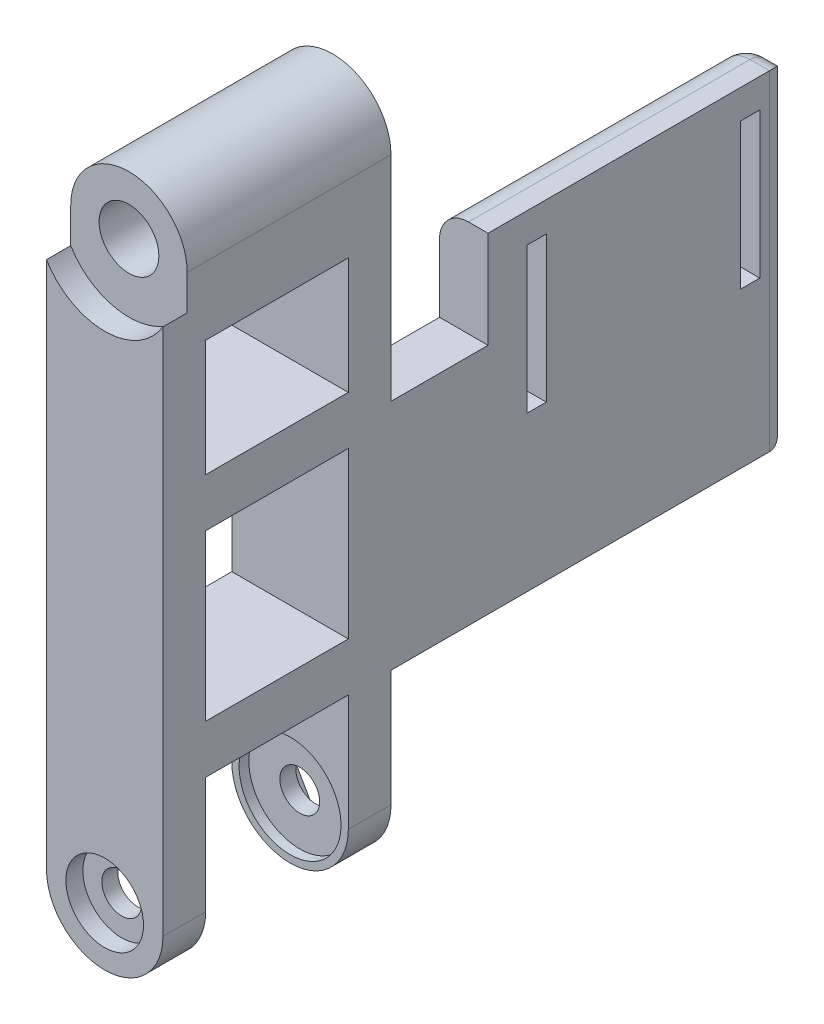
SolidWorks part; units mm, degrees
ref_plane "前视基准面" through (0, 0, 0) normal (0, 0, 1) x (1, 0, 0)
ref_plane "上视基准面" through (0, 0, 0) normal (0, 1, 0) x (1, 0, 0)
ref_plane "右视基准面" through (0, 0, 0) normal (1, 0, 0) x (0, 0, -1)
other "Configuration Table"
sketch "草图1" plane through (0, 0, 0) normal (0, 0, 1) x (1, 0, 0)
  line L2 (0, 0) -> (0, 58)
  line L4 (12, 0) -> (12, 58)
  arc A0 (0, 58) -> (12, 58) centre (6, 58) cw
  arc A1 (12, 0) -> (0, 0) centre (6, 0) cw
  circle A2 centre (6, 58) radius 3.08
  circle A3 centre (6, 0) radius 2.05
  dimension "D1" = 12
  dimension "D2" = 58
extrude "凸台-拉伸7" add sketch "草图1" against normal blind 25.5
sketch "草图6" plane through (12, 0, 0) normal (1, 0, 0) x (0, 0, -1)
  line L1 (5.4, -6) -> (20.1, -6)
  line L2 (5.4, -6) -> (5.4, 12)
  line L3 (5.4, 12) -> (20.1, 12)
  line L4 (20.1, -6) -> (20.1, 12)
  line L5 (0, 0) -> (0, -6) construction
  line L7 (5.4, 17) -> (20.1, 17)
  line L8 (5.4, 17) -> (5.4, 34)
  line L9 (5.4, 34) -> (20.1, 34)
  line L10 (20.1, 17) -> (20.1, 34)
  line L15 (5.4, 39) -> (20.1, 39)
  line L24 (5.4, 39) -> (5.4, 51)
  line L25 (5.4, 51) -> (20.1, 51)
  line L26 (20.1, 39) -> (20.1, 51)
  dimension "D6" = 12
  dimension "D1" = 14.7
  dimension "D2" = 5.4
  dimension "D3" = 5
  dimension "D4" = 5
  dimension "D5" = 17
extrude "切除-拉伸1" cut sketch "草图6" against normal blind 20
sketch "草图7" plane through (0, 0, 0) normal (0, 0, 1) x (1, 0, 0)
  circle A0 centre (6, 0) radius 3.15
extrude "切除-拉伸2" cut sketch "草图7" against normal blind 2.75
sketch "草图8" plane through (0, 0, -25.5) normal (0, 0, -1) x (-1, 0, 0)
  line L1 (-2.6514, 0) -> (-4.3257, 2.9)
  line L2 (-4.3257, 2.9) -> (-7.6743, 2.9)
  line L3 (-7.6743, 2.9) -> (-9.3486, 0)
  line L4 (-9.3486, 0) -> (-7.6743, -2.9)
  line L5 (-7.6743, -2.9) -> (-4.3257, -2.9)
  line L6 (-4.3257, -2.9) -> (-2.6514, 0)
  circle A0 centre (-6, 0) radius 2.9 construction
extrude "切除-拉伸3" cut sketch "草图8" against normal blind 2.75
sketch "草图9" plane through (0, 0, -25.5) normal (0, 0, -1) x (-1, 0, 0)
  line L5 (-12, 12) -> (-7, 12)
  line L6 (-12, 0) -> (-12, 58) construction
  line L7 (-12, 36) -> (-7, 36)
  line L8 (-12, 36) -> (-12, 12)
  line L10 (-7, 36) -> (-7, 12)
  circle A0 centre (-6, 0) radius 2.05 construction
  dimension "D1" = 12
  dimension "D2" = 24
  dimension "D3" = 5
extrude "凸台-拉伸8" add sketch "草图9" along normal blind 40
sketch "草图11" plane through (0, 0, 0) normal (0, 0, 1) x (1, 0, 0)
  circle A0 centre (6, 58) radius 7
extrude "切除-拉伸5" cut sketch "草图11" against normal blind 3.5
sketch "草图12" plane through (0, 0, -25.5) normal (0, 0, -1) x (-1, 0, 0)
  circle A0 centre (-6, 58) radius 7
extrude "切除-拉伸6" cut sketch "草图12" against normal blind 1
sketch "草图13" plane through (0, 0, 0) normal (0, 0, 1) x (1, 0, 0)
  line L0 (0, 0) -> (0, 54.3944)
  line L1 (12, 54.3944) -> (12, 0)
  arc A0 (0, 54.3944) -> (12, 54.3944) centre (6, 58) ccw
  arc A1 (0, 0) -> (12, 0) centre (6, 0) ccw
extrude "切除-拉伸7" cut sketch "草图13" against normal blind 1
sketch "草图14" plane through (0, 0, -25.5) normal (0, 0, -1) x (-1, 0, 0)
  line L0 (-12, 54.3944) -> (-12, 36)
  line L1 (-12, 36) -> (-7, 36)
  line L2 (-7, 36) -> (-7, 12)
  line L3 (-7, 12) -> (-12, 12)
  line L4 (-12, 12) -> (-12, 0)
  line L5 (0, 54.3944) -> (0, 0)
  arc A0 (-12, 54.3944) -> (0, 54.3944) centre (-6, 58) ccw
  arc A1 (-12, 0) -> (0, 0) centre (-6, 0) ccw
extrude "切除-拉伸8" cut sketch "草图14" against normal blind 1
sketch "草图15" plane through (0, 0, -5.4) normal (0, 0, -1) x (-1, 0, 0)
  circle A0 centre (-6, 0) radius 5.25
extrude "切除-拉伸9" cut sketch "草图15" against normal blind 1
sketch "草图16" plane through (0, 0, -20.1) normal (0, 0, 1) x (1, 0, 0)
  circle A0 centre (6, 0) radius 5.25
extrude "切除-拉伸10" cut sketch "草图16" against normal blind 1
fillet "圆角1" radius 3 1 edges at (7, 12, -45)
sketch "草图17" plane through (0, 36, 0) normal (0, 1, 0) x (1, 0, 0)
  line L0 (12, 65.5) -> (12, 24.5) construction
  line L1 (7, 65.5) -> (12, 65.5)
  line L2 (7, 65.5) -> (7, 34.5)
  line L3 (7, 34.5) -> (12, 34.5)
  line L4 (12, 65.5) -> (12, 34.5)
  line L5 (12, 24.5) -> (7, 24.5) construction
  dimension "D1" = 10
extrude "凸台-拉伸9" add sketch "草图17" along normal blind 10
sketch "草图10" plane through (12, 0, 0) normal (1, 0, 0) x (0, 0, -1)
  line L0 (65.5, 46) -> (65.5, 12) construction
  line L1 (38.5, 42.9325) -> (40.5, 42.9325)
  line L3 (38.5, 27.9325) -> (40.5, 27.9325)
  line L4 (40.5, 42.9325) -> (40.5, 27.9325)
  line L5 (60.5, 43) -> (62.5, 43)
  line L6 (60.5, 43) -> (60.5, 28)
  line L7 (60.5, 28) -> (62.5, 28)
  line L8 (62.5, 43) -> (62.5, 28)
  line L9 (38.5, 42.9325) -> (38.5, 27.9325)
  line L10 (34.5, 46) -> (65.5, 46) construction
  dimension "D1" = 2
  dimension "D2" = 2
  dimension "D3" = 3
  dimension "D4" = 20
  dimension "D5" = 3
  dimension "D7" = 15
extrude "切除-拉伸4" cut sketch "草图10" against normal blind 10
fillet "圆角2" radius 3 1 edges at (7, 46, -50)
fillet "圆角3" radius 2 6 edges at (11, 12, -65.5) (7.8787, 12.8787, -65.5) (11, 46, -65.5) (7.8787, 45.1213, -65.5) (12, 29, -65.5) (7, 29, -65.5)
sketch "草图18" plane through (0, 0, -1) normal (0, 0, 1) x (1, 0, 0)
  circle A0 centre (6, 0) radius 4
extrude "切除-拉伸11" cut sketch "草图18" against normal up to surface (1.75 mm away)
sketch "草图19" plane through (0, 0, -24.5) normal (0, 0, -1) x (-1, 0, 0)
  line L1 (-1.5, 0) -> (-3.75, 3.8971)
  line L2 (-3.75, 3.8971) -> (-8.25, 3.8971)
  line L3 (-8.25, 3.8971) -> (-10.5, 0)
  line L4 (-10.5, 0) -> (-8.25, -3.8971)
  line L5 (-8.25, -3.8971) -> (-3.75, -3.8971)
  line L6 (-3.75, -3.8971) -> (-1.5, 0)
  circle A0 centre (-6, 0) radius 3.8971 construction
  dimension "D1" = 4.5
extrude "切除-拉伸12" cut sketch "草图19" against normal up to surface (1.75 mm away)
